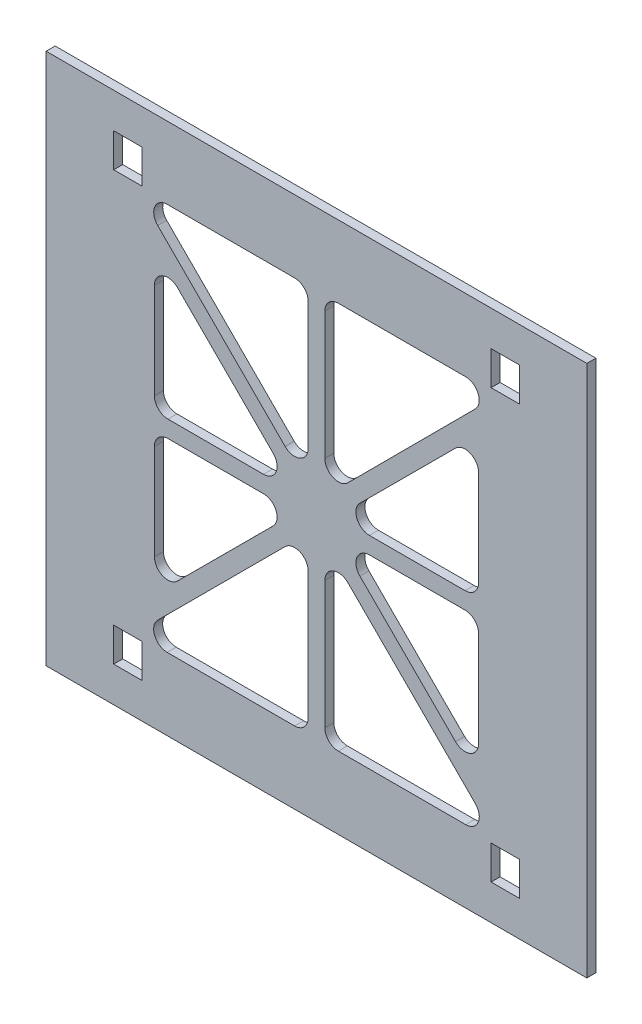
SolidWorks part; units mm, degrees
ref_plane "Alzado" through (0, 0, 0) normal (0, 0, 1) x (1, 0, 0)
ref_plane "Planta" through (0, 0, 0) normal (0, 1, 0) x (1, 0, 0)
ref_plane "Vista lateral" through (0, 0, 0) normal (1, 0, 0) x (0, 0, -1)
sketch "Model" plane through (0, 0, 0) normal (0, 0, 1) x (1, 0, 0)
  line L1 (-1.016, 80.122) -> (-1.016, 174.6116)
  line L2 (-1.016, 79.022) -> (-1.016, 175.7116) construction
  line L3 (94.968, 174.6116) -> (94.968, 80.122)
  line L4 (43.0944, 136.7727) -> (50.8576, 117.9881) construction
  line L5 (46.976, 127.3804) -> (86.976, 127.3804) construction
  line L6 (46.976, 127.3804) -> (46.976, 167.3804) construction
  line L7 (6.976, 86.3804) -> (86.976, 86.3804)
  line L8 (6.976, 86.3804) -> (6.976, 168.3804)
  line L9 (86.976, 86.3804) -> (86.976, 168.3804)
  line L10 (6.976, 168.3804) -> (86.976, 168.3804)
  line L11 (6.976, 86.3804) -> (86.976, 168.3804) construction
  line L12 (86.976, 86.3804) -> (6.976, 168.3804) construction
  line L13 (6.976, 86.3804) -> (10.976, 86.3804)
  line L14 (15.9768, 97.3822) -> (15.9768, 105.3822)
  line L15 (15.9768, 105.3822) -> (10.976, 105.3822)
  line L16 (10.976, 105.3822) -> (10.976, 97.3822)
  line L17 (10.976, 92.3814) -> (15.9768, 92.3814)
  line L18 (10.976, 169.8806) -> (10.976, 168.3804)
  line L19 (10.976, 86.3804) -> (15.9768, 86.3804)
  line L20 (15.9768, 169.8806) -> (10.976, 169.8806)
  line L21 (15.9768, 157.3786) -> (10.976, 157.3786)
  line L22 (10.976, 92.3814) -> (10.976, 97.3822)
  line L23 (10.976, 92.3814) -> (10.976, 86.3804)
  line L24 (15.9768, 86.3804) -> (15.9768, 84.8802)
  line L25 (15.9768, 86.3804) -> (15.9768, 97.3822)
  line L26 (15.9768, 97.3822) -> (10.976, 97.3822)
  line L27 (15.9768, 84.8802) -> (10.976, 84.8802)
  line L28 (10.976, 84.8802) -> (10.976, 86.3804)
  line L29 (15.9768, 168.3804) -> (15.9768, 157.3786)
  line L30 (15.9768, 168.3804) -> (15.9768, 169.8806)
  line L31 (10.976, 162.3794) -> (10.976, 168.3804)
  line L32 (10.976, 162.3794) -> (10.976, 157.3786)
  line L33 (10.976, 168.3804) -> (15.9768, 168.3804)
  line L34 (10.976, 162.3794) -> (15.9768, 162.3794)
  line L35 (10.976, 149.3786) -> (10.976, 157.3786)
  line L36 (15.9768, 149.3786) -> (10.976, 149.3786)
  line L37 (15.9768, 157.3786) -> (15.9768, 149.3786)
  line L38 (82.976, 84.8802) -> (82.976, 86.3804)
  line L39 (77.9752, 84.8802) -> (82.976, 84.8802)
  line L40 (77.9752, 97.3822) -> (82.976, 97.3822)
  line L41 (82.976, 162.3794) -> (77.9752, 162.3794)
  line L42 (52.5555, 119.6843) -> (75.1711, 97.0449)
  line L43 (82.976, 168.3804) -> (77.9752, 168.3804)
  line L44 (82.976, 162.3794) -> (82.976, 157.3786)
  line L45 (82.976, 162.3794) -> (82.976, 168.3804)
  line L46 (77.9752, 168.3804) -> (77.9752, 169.8806)
  line L47 (77.9752, 168.3804) -> (77.9752, 157.3786)
  line L48 (77.9752, 157.3786) -> (82.976, 157.3786)
  line L49 (77.9752, 169.8806) -> (82.976, 169.8806)
  line L50 (82.976, 169.8806) -> (82.976, 168.3804)
  line L51 (77.9752, 86.3804) -> (77.9752, 97.3822)
  line L52 (77.9752, 86.3804) -> (77.9752, 84.8802)
  line L53 (82.976, 92.3814) -> (82.976, 86.3804)
  line L54 (82.976, 92.3814) -> (82.976, 97.3822)
  line L55 (82.976, 86.3804) -> (77.9752, 86.3804)
  line L56 (82.976, 92.3814) -> (77.9752, 92.3814)
  line L57 (94.968, 80.122) -> (-1.016, 80.122)
  line L59 (-1.016, 174.6116) -> (94.968, 174.6116)
  line L61 (93.868, 80.122) -> (0.084, 80.122) construction
  line L62 (0.084, 174.6116) -> (93.868, 174.6116) construction
  line L63 (94.968, 175.7116) -> (94.968, 79.022) construction
  line L78 (48.4576, 95.3488) -> (48.4576, 117.9881)
  line L103 (73.4731, 92.9488) -> (50.8576, 92.9488)
  line L139 (43.0944, 92.9333) -> (20.467, 92.9333)
  line L164 (45.4944, 117.9607) -> (45.4944, 95.3333)
  line L203 (18.7699, 97.0303) -> (41.3973, 119.6577)
  line L242 (39.2799, 121.7737) -> (22.3004, 104.812)
  line L279 (20.6042, 125.8716) -> (37.5837, 125.8716)
  line L304 (18.2042, 106.51) -> (18.2042, 123.4716)
  line L340 (18.2037, 131.2636) -> (18.2037, 148.2247)
  line L365 (37.5837, 128.8636) -> (20.6037, 128.8636)
  line L403 (22.2998, 149.9227) -> (39.2798, 132.9616)
  line L442 (41.3964, 135.0766) -> (18.7816, 157.7166)
  line L479 (45.4944, 159.4127) -> (45.4944, 136.7727)
  line L504 (20.4796, 161.8127) -> (43.0944, 161.8127)
  line L541 (50.8576, 161.7972) -> (73.4605, 161.7972)
  line L566 (48.4576, 136.7453) -> (48.4576, 159.3972)
  line L567 (75.1594, 157.702) -> (52.5565, 135.0501)
  line L605 (54.6722, 132.9616) -> (71.6522, 149.9227)
  line L641 (73.3483, 128.8636) -> (56.3683, 128.8636)
  line L666 (75.7483, 148.2247) -> (75.7483, 131.2636)
  line L703 (75.7478, 123.4716) -> (75.7478, 106.51)
  line L728 (56.3683, 125.8716) -> (73.3478, 125.8716)
  line L767 (71.6516, 104.812) -> (54.6721, 121.7737)
  line L768 (94.968, 79.022) -> (-1.016, 79.022) construction
  line L769 (-1.016, 175.7116) -> (94.968, 175.7116) construction
  line L770 (93.868, 174.6116) -> (93.868, 80.122) construction
  line L771 (0.084, 80.122) -> (0.084, 174.6116) construction
  arc A0 (48.4576, 136.7453) -> (52.5565, 135.0501) centre (50.8576, 136.7453) ccw
  arc A1 (75.1594, 157.702) -> (73.4605, 161.7972) centre (73.4605, 159.3972) ccw
  arc A2 (50.8576, 161.7972) -> (48.4576, 159.3972) centre (50.8576, 159.3972) ccw
  arc A3 (73.3483, 128.8636) -> (75.7483, 131.2636) centre (73.3483, 131.2636) ccw
  arc A4 (75.7483, 148.2247) -> (71.6522, 149.9227) centre (73.3483, 148.2247) ccw
  arc A5 (54.6722, 132.9616) -> (56.3683, 128.8636) centre (56.3683, 131.2636) ccw
  arc A6 (75.7478, 123.4716) -> (73.3478, 125.8716) centre (73.3478, 123.4716) ccw
  arc A7 (54.6721, 121.7737) -> (56.3683, 125.8716) centre (56.3683, 123.4716) cw
  arc A8 (75.7478, 106.51) -> (71.6516, 104.812) centre (73.3478, 106.51) cw
  arc A9 (73.4731, 92.9488) -> (75.1711, 97.0449) centre (73.4731, 95.3488) ccw
  arc A10 (52.5555, 119.6843) -> (48.4576, 117.9881) centre (50.8576, 117.9881) ccw
  arc A11 (50.8576, 92.9488) -> (48.4576, 95.3488) centre (50.8576, 95.3488) cw
  arc A12 (41.3973, 119.6577) -> (45.4944, 117.9607) centre (43.0944, 117.9607) cw
  arc A13 (45.4944, 95.3333) -> (43.0944, 92.9333) centre (43.0944, 95.3333) cw
  arc A14 (20.467, 92.9333) -> (18.7699, 97.0303) centre (20.467, 95.3333) cw
  arc A15 (37.5837, 125.8716) -> (39.2799, 121.7737) centre (37.5837, 123.4716) cw
  arc A16 (22.3004, 104.812) -> (18.2042, 106.51) centre (20.6042, 106.51) cw
  arc A17 (18.2042, 123.4716) -> (20.6042, 125.8716) centre (20.6042, 123.4716) cw
  arc A18 (39.2798, 132.9616) -> (37.5837, 128.8636) centre (37.5837, 131.2636) cw
  arc A19 (20.6037, 128.8636) -> (18.2037, 131.2636) centre (20.6037, 131.2636) cw
  arc A20 (18.2037, 148.2247) -> (22.2998, 149.9227) centre (20.6037, 148.2247) cw
  arc A21 (45.4944, 136.7727) -> (41.3964, 135.0766) centre (43.0944, 136.7727) cw
  arc A22 (45.4944, 159.4127) -> (43.0944, 161.8127) centre (43.0944, 159.4127) ccw
  arc A23 (20.4796, 161.8127) -> (18.7816, 157.7166) centre (20.4796, 159.4127) ccw
  dimension "D1" = 82
  dimension "D2" = 1.5002
  dimension "D3" = 1.1
extrude "Boss-Extrude1" add sketch "Model" against normal blind 1.6
